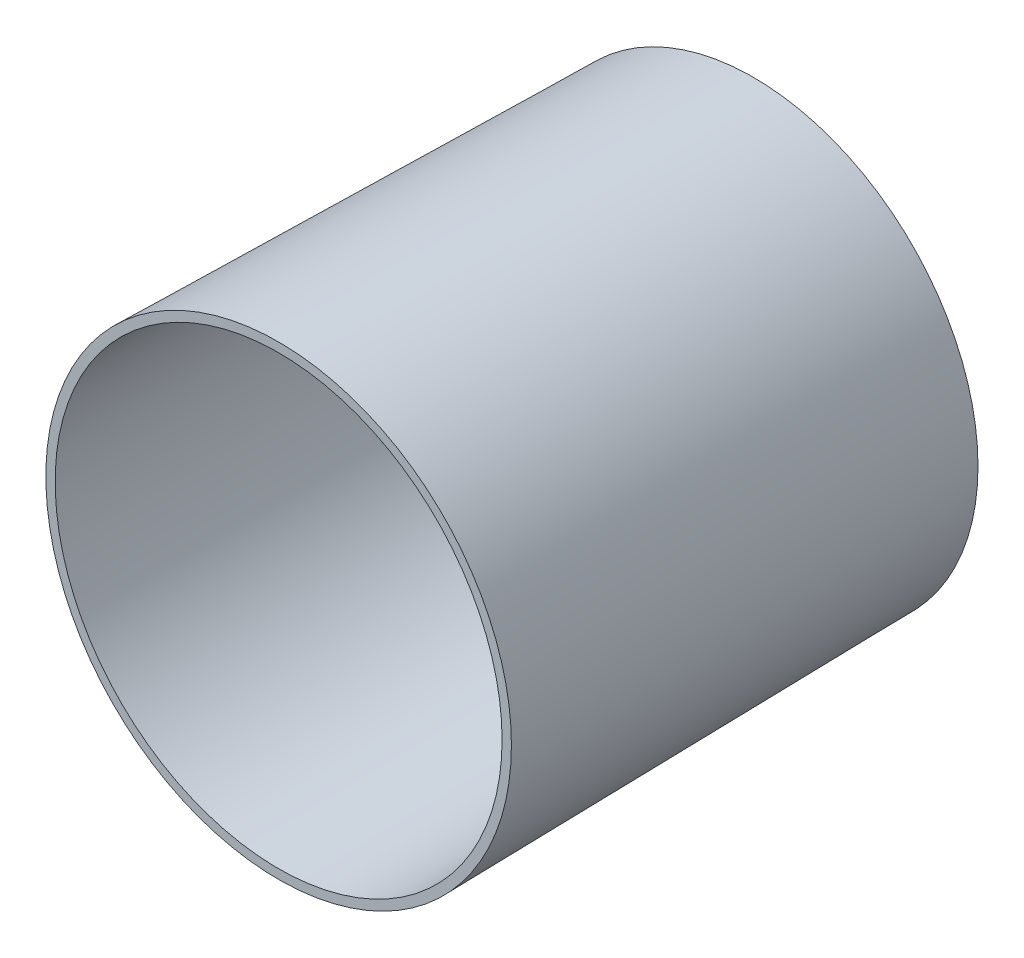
SolidWorks part; units mm, degrees
ref_plane "Ebene vorne" through (0, 0, 0) normal (0, 0, 1) x (1, 0, 0)
ref_plane "Ebene oben" through (0, 0, 0) normal (0, 1, 0) x (1, 0, 0)
ref_plane "Ebene rechts" through (0, 0, 0) normal (1, 0, 0) x (0, 0, -1)
sketch "Skizze1" plane through (0, 0, 0) normal (0, 1, 0) x (1, 0, 0)
  line L0 (-55, -50) -> (-55.8728, 0)
  line L1 (-55, 0) -> (55, 0) construction
  line L2 (-55.8728, 0) -> (-55.8902, 1)
  line L3 (-55.8902, 1) -> (-56.8815, 1)
  line L4 (-56.8815, 1) -> (-56.8815, 0)
  line L5 (-56.8815, 0) -> (-80, 0)
  line L6 (-80, 0) -> (-80, -1)
  line L7 (-80, -1) -> (-56.8555, -1)
  line L8 (-56.8555, -1) -> (-56.0002, -50)
  line L9 (-56.0002, -50) -> (-55, -50)
  line L10 (-80, -35.8456) -> (-80, 9.4739) construction
  line L11 (0, -55) -> (0, 55) construction
  point P14 (-55.8815, 0.5)
  dimension "D1" = 1
  dimension "D2" = 1
  dimension "D3" = 1
  dimension "D4" = 1
  dimension "D5" = 1
  dimension "D6" = 25
  dimension "D7" = 80
  dimension "D8" = 50
revolve "Rotation1" add sketch "Skizze1" angle 360 about L10
fillet "Verrundung1" radius 1 1 edges at (-56.8555, 0, 1)
